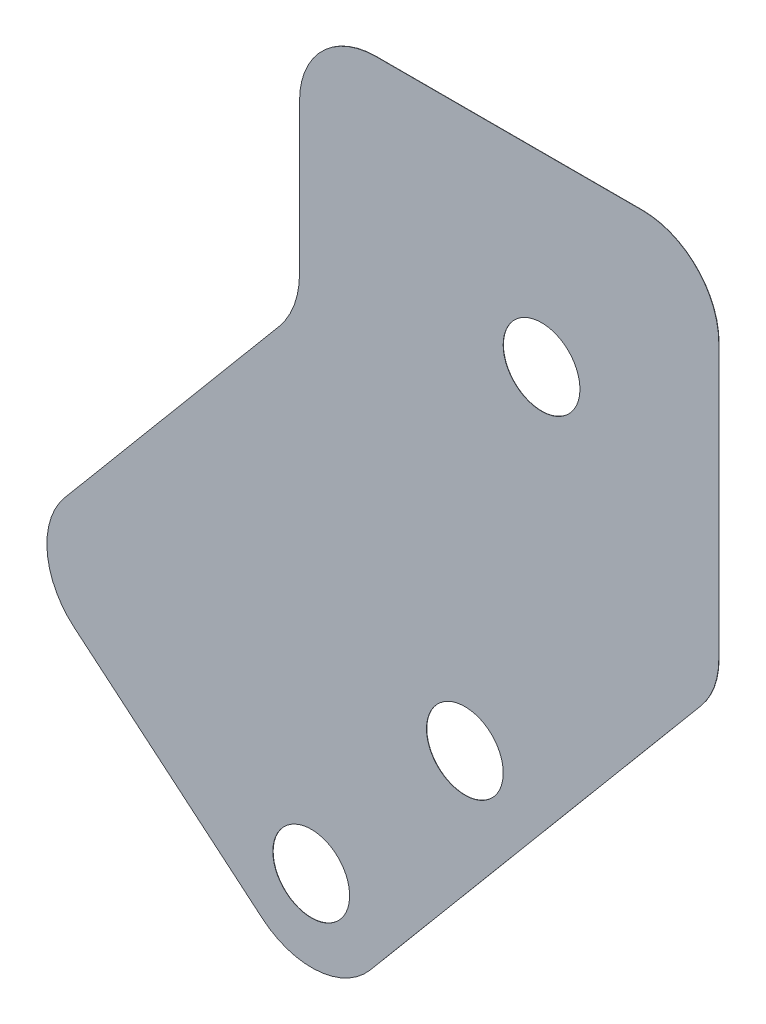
SolidWorks part; units mm, degrees
ref_plane "Front" through (0, 0, 0) normal (0, 0, 1) x (1, 0, 0)
ref_plane "Top" through (0, 0, 0) normal (0, 1, 0) x (1, 0, 0)
ref_plane "Right" through (0, 0, 0) normal (1, 0, 0) x (0, 0, -1)
sketch "Sketch1" plane through (0, 0, 0) normal (0, 0, 1) x (1, 0, 0)
  line L12 (-552.9512, -13.7079) -> (-577.7162, -13.7079)
  line L13 (-545.8392, -46.3196) -> (-545.8392, -20.8199)
  line L14 (-578.2513, -87.5355) -> (-547.503, -50.8911)
  line L15 (-605.7827, -73.7179) -> (-588.2709, -88.4121)
  line L16 (-586.7297, -39.9472) -> (-606.6593, -63.6983)
  line L17 (-584.8282, -20.8199) -> (-584.8282, -34.7227)
  line L18 (-552.9512, -13.7079) -> (-577.7162, -13.7079)
  line L19 (-545.8392, -46.3196) -> (-545.8392, -20.8199)
  line L20 (-578.2513, -87.5355) -> (-547.503, -50.8911)
  line L21 (-605.7827, -73.7179) -> (-588.2709, -88.4121)
  line L22 (-586.7297, -39.9472) -> (-606.6593, -63.6983)
  line L23 (-584.8282, -20.8199) -> (-584.8282, -34.7227)
  arc A12 (-545.8392, -20.8199) -> (-552.9512, -13.7079) centre (-552.9512, -20.8199) ccw
  arc A13 (-547.503, -50.8911) -> (-545.8392, -46.3196) centre (-552.9512, -46.3196) ccw
  arc A14 (-588.2709, -88.4121) -> (-578.2513, -87.5355) centre (-583.6994, -82.9639) ccw
  arc A15 (-606.6593, -63.6983) -> (-605.7827, -73.7179) centre (-601.2112, -68.2698) ccw
  arc A16 (-586.7297, -39.9472) -> (-584.8282, -34.7227) centre (-592.9562, -34.7227) ccw
  arc A17 (-577.7162, -13.7079) -> (-584.8282, -20.8199) centre (-577.7162, -20.8199) ccw
  arc A18 (-545.8392, -20.8199) -> (-552.9512, -13.7079) centre (-552.9512, -20.8199) ccw
  arc A19 (-547.503, -50.8911) -> (-545.8392, -46.3196) centre (-552.9512, -46.3196) ccw
  arc A20 (-588.2709, -88.4121) -> (-578.2513, -87.5355) centre (-583.6994, -82.9639) ccw
  arc A21 (-606.6593, -63.6983) -> (-605.7827, -73.7179) centre (-601.2112, -68.2698) ccw
  arc A22 (-586.7297, -39.9472) -> (-584.8282, -34.7227) centre (-592.9562, -34.7227) ccw
  arc A42 (-577.7162, -13.7079) -> (-584.8282, -20.8199) centre (-577.7162, -20.8199) ccw
  dimension "D1" = 0.508
extrude "Boss-Extrude1" add sketch "Sketch1" along normal blind 0.0254 separate body
hole_wizard "Hole1" positions "Point_Sketch" profile "Profil_Sketch" hole size "Ø0.15" standard "ISO"
sketch "Point_Sketch" plane through (-580.0679, -71.9155, 0) normal (0, 0, 1) x (-1, 0, 0)
  point P0 (3.6706, 10.6011)
  point P2 (-17.7441, -40.9069)
  point P4 (-10.6154, -6.4242)
sketch "Profil_Sketch" plane through (-583.7385, -82.5166, 0) normal (1, 0, 0) x (0, 1, 0)
  line L0 (0, 0) -> (0, 0.0254)
  line L1 (0, 0.0254) -> (3.5687, 0.0254)
  line L2 (3.5687, 0.0254) -> (3.5687, 0)
  line L5 (3.5687, 0) -> (0, 0)
  line L11 (0, -6.35) -> (0, 107.95) construction
  dimension "Diameter" = 7.1374
  dimension "Thru Hole Depth" = 0.0254
other "usin_DL090_.25-20x3-SHCS<1>"
